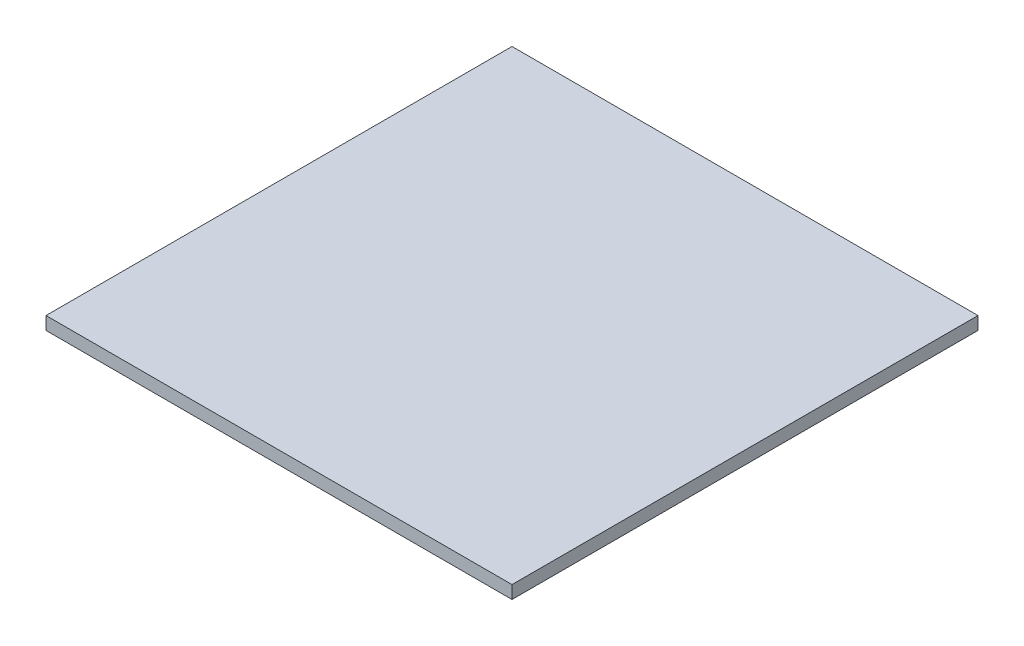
SolidWorks part; units mm, degrees
ref_plane "Front Plane" through (0, 0, 0) normal (0, 0, 1) x (1, 0, 0)
ref_plane "Top Plane" through (0, 0, 0) normal (0, 1, 0) x (1, 0, 0)
ref_plane "Right Plane" through (0, 0, 0) normal (1, 0, 0) x (0, 0, -1)
sketch "Sketch1" plane through (0, 0, 0) normal (0, 1, 0) x (1, 0, 0)
  line L0 (228.6, 228.6) -> (-228.6, -228.6) construction
  line L1 (-228.6, 228.6) -> (228.6, 228.6)
  line L2 (-228.6, 228.6) -> (-228.6, -228.6)
  line L3 (-228.6, -228.6) -> (228.6, -228.6)
  line L4 (228.6, 228.6) -> (228.6, -228.6)
  point P5 (0, 0)
  dimension "D1" = 457.2
  dimension "D2" = 457.2
extrude "Extrude1" add sketch "Sketch1" against normal blind 12.7
